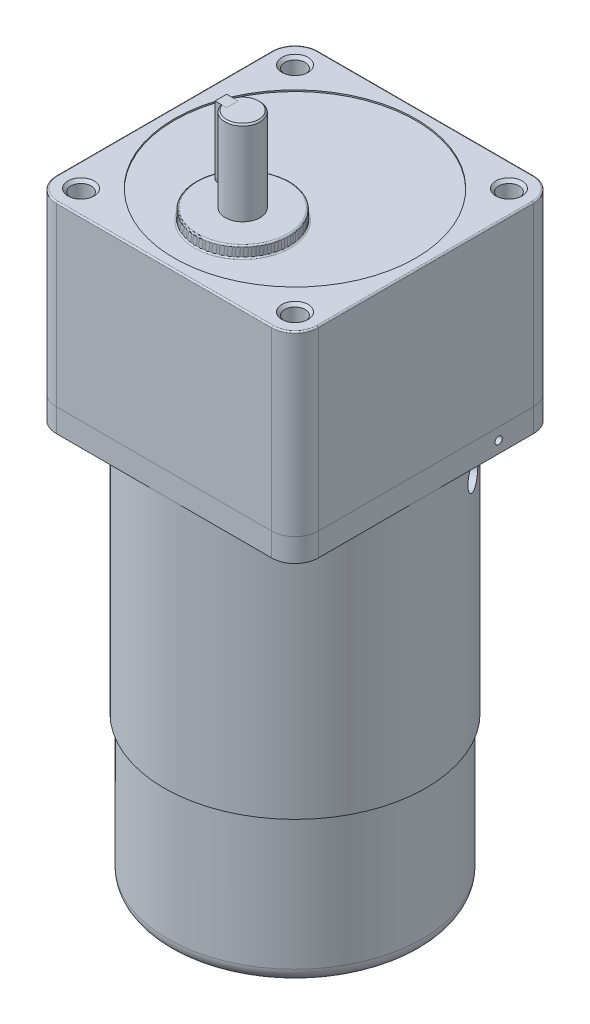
SolidWorks part; units mm, degrees
ref_plane "前视基准面" through (0, 0, 0) normal (0, 0, 1) x (1, 0, 0)
ref_plane "上视基准面" through (0, 0, 0) normal (0, 1, 0) x (1, 0, 0)
ref_plane "右视基准面" through (0, 0, 0) normal (1, 0, 0) x (0, 0, -1)
imported_body "复件 (4) 51k40cc-00机壳 9024.0040.106-00-1-surface1"
imported_body "复件 (4) 51k40cc-00机壳 9024.0040.106-00-1-surface2"
imported_body "9053.0180.101.01箱体-1-surface1"
imported_body "9053.0180.101.01箱体-1-surface2"
imported_body "9053.0180.101.01箱体-1-surface3"
sketch "草图2" plane through (0, 132.1778, 0) normal (0, 1, 0) x (1, 0, 0)
  circle A0 centre (-49.4412, -18) radius 16
extrude "凸台-拉伸1" add sketch "草图2" along normal blind 3.8
sketch "草图4" plane through (0, 135.9778, 0) normal (0, 1, 0) x (1, 0, 0)
  circle A0 centre (-49.4412, -18) radius 6
extrude "凸台-拉伸2" add sketch "草图4" along normal blind 29 contours A0
ref_plane "基准面1" through (-55.442, 0, 0) normal (1, 0, 0) x (0, 0, -1)
sketch "草图5" plane through (-55.442, 0, 0) normal (1, 0, 0) x (0, 0, -1)
  line L1 (-12, 164.9778) -> (-24, 164.9778) construction
  line L2 (-16, 141.9778) -> (-16, 164.9778)
  line L3 (-16, 164.9778) -> (-20, 164.9778)
  line L4 (-20, 164.9778) -> (-20, 141.9778)
  arc A0 (-20, 141.9778) -> (-16, 141.9778) centre (-18, 141.9778) ccw
extrude "切除-拉伸1" cut sketch "草图5" along normal blind 2.5
sketch "草图6" plane through (-52.942, 0, 0) normal (-1, 0, 0) x (0, 0, 1)
  line L0 (16, 141.9778) -> (16, 164.9778)
  line L1 (16, 164.9778) -> (20, 164.9778)
  line L2 (20, 164.9778) -> (20, 141.9778)
  arc A0 (16, 141.9778) -> (20, 141.9778) centre (18, 141.9778) ccw
extrude "凸台-拉伸3" add sketch "草图6" along normal blind 4 separate body
chamfer "倒角1" distance 0.5 angle 45 1 edges at (-43.4412, 164.9778, 18)
fillet "圆角1" radius 0.5 1 edges at (-65.4412, 135.9778, 18)
